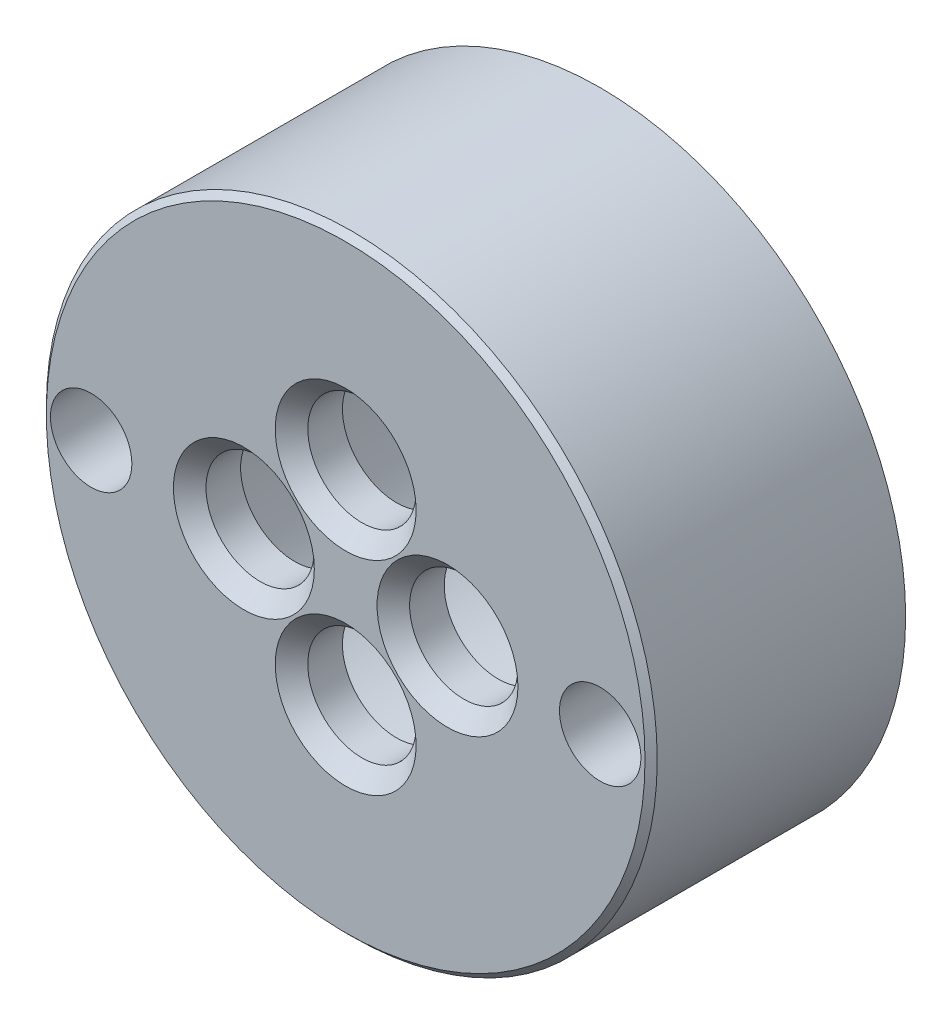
SolidWorks part; units mm, degrees
ref_plane "Front Plane" through (0, 0, 0) normal (0, 0, 1) x (1, 0, 0)
ref_plane "Top Plane" through (0, 0, 0) normal (0, 1, 0) x (1, 0, 0)
ref_plane "Right Plane" through (0, 0, 0) normal (1, 0, 0) x (0, 0, -1)
sketch "Sketch1" plane through (0, 0, 0) normal (0, 0, 1) x (1, 0, 0)
  circle A0 centre (-101.092, -101.6) radius 19.05
  circle A1 centre (-101.092, -101.6) radius 11.1125 construction
  circle A2 centre (-101.092, -101.6) radius 11.1125
  dimension "D1" = 38.1
extrude "body" add sketch "Sketch1" along normal blind 12.7
sketch "Sketch2" plane through (0, 0, 12.7) normal (0, 0, 1) x (1, 0, 0)
  circle A0 centre (-101.092, -101.6) radius 19.05 construction
  circle A1 centre (-101.092, -101.6) radius 19.05
extrude "top" add sketch "Sketch2" along normal blind 3.175
sketch "Sketch3" plane through (0, 0, 15.875) normal (0, 0, 1) x (1, 0, 0)
  line L0 (-79.1662, -101.6) -> (-124.5325, -101.6) construction
  circle A0 centre (-101.092, -101.6) radius 15.875 construction
  circle A1 centre (-116.967, -101.6) radius 2.54
  circle A2 centre (-85.217, -101.6) radius 2.54
  dimension "D1" = 31.75
  dimension "D2" = 5.08
  dimension "D3" = 5.08
extrude "mount holes" cut sketch "Sketch3" against normal through all
sketch "Sketch4" plane through (0, 0, 15.875) normal (0, 0, 1) x (1, 0, 0)
  line L0 (-101.092, -120.65) -> (-101.092, -83.5022) construction
  line L1 (-118.8263, -101.6) -> (-82.4633, -101.6) construction
  line L2 (-120.142, -101.6) -> (-123.773, -101.6) construction
  circle A0 centre (-101.092, -101.6) radius 19.05 construction
  circle A1 centre (-101.092, -101.6) radius 6.35 construction
  circle A2 centre (-94.742, -101.6) radius 3.3782
  circle A3 centre (-101.092, -107.95) radius 3.3782
  circle A4 centre (-107.442, -101.6) radius 3.3782
  circle A5 centre (-101.092, -95.25) radius 3.3782
  dimension "D1" = 12.7
  dimension "D2" = 6.7564
  dimension "D3" = 6.7564
  dimension "D4" = 6.7564
  dimension "D5" = 6.7564
extrude "vent holes" cut sketch "Sketch4" against normal through all
chamfer "outer edge" distance 0.381 angle 45 1 edges at (-82.042, -101.6, 15.875)
chamfer "vent" distance 1.016 angle 45 4 edges at (-104.0638, -101.6, 15.875) (-97.7138, -107.95, 15.875) (-97.7138, -95.25, 15.875) (-91.3638, -101.6, 15.875)
